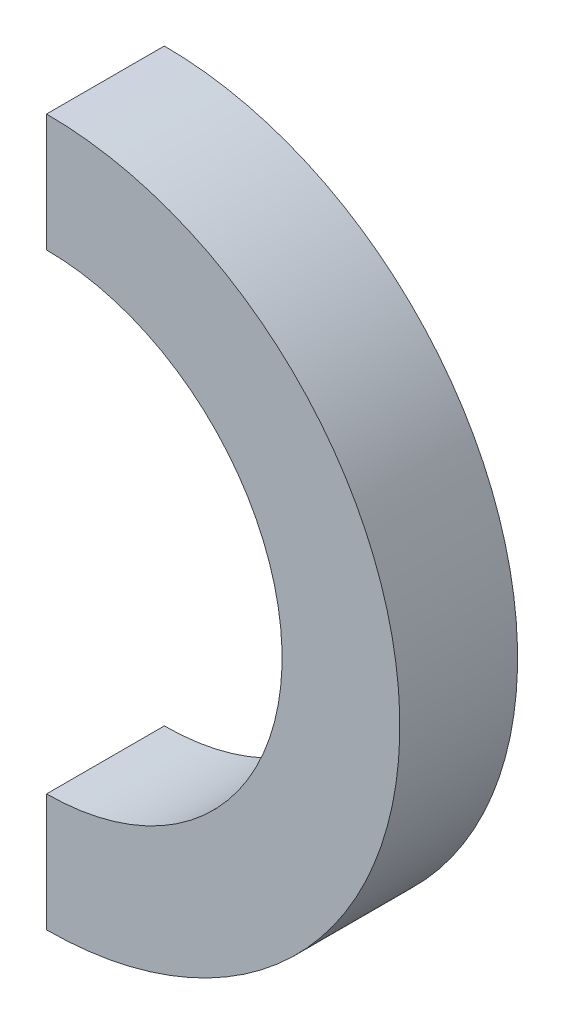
SolidWorks part; units mm, degrees
ref_plane "Front Plane" through (0, 0, 0) normal (0, 0, 1) x (1, 0, 0)
ref_plane "Top Plane" through (0, 0, 0) normal (0, 1, 0) x (1, 0, 0)
ref_plane "Right Plane" through (0, 0, 0) normal (1, 0, 0) x (0, 0, -1)
sketch "Sketch1" plane through (0, 0, 0) normal (0, 0, 1) x (1, 0, 0)
  line L0 (0, 19.05) -> (0, 12.7)
  line L1 (0, -12.7) -> (0, -19.05)
  arc A0 (0, 12.7) -> (0, -12.7) centre (0, 0) cw
  arc A1 (0, 19.05) -> (0, -19.05) centre (0, 0) cw
  dimension "D1" = 6.35
  dimension "D2" = 25.4
  dimension "D3" = 12.7
extrude "Finger" add sketch "Sketch1" along normal blind 6.35
